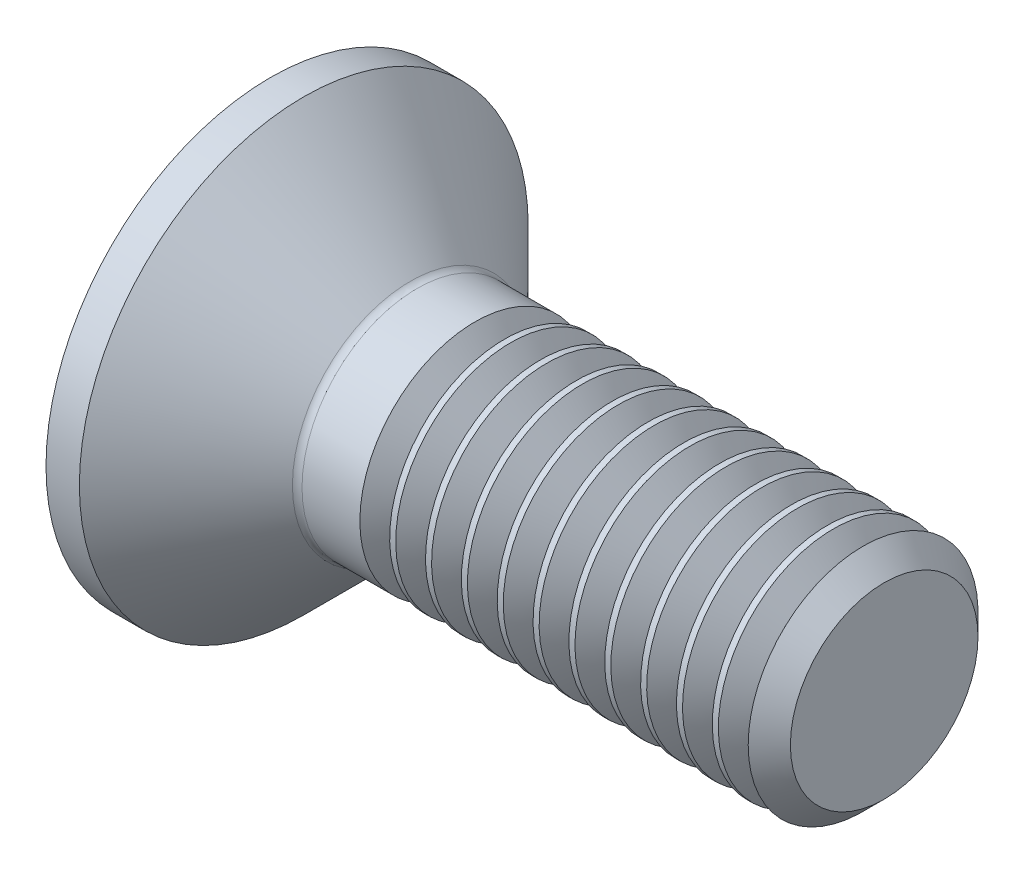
SolidWorks part; units mm, degrees
ref_plane "Plane1" through (0, 0, 0) normal (0, 0, 1) x (1, 0, 0)
ref_plane "Plane2" through (0, 0, 0) normal (0, 1, 0) x (1, 0, 0)
ref_plane "Plane3" through (0, 0, 0) normal (1, 0, 0) x (0, 0, -1)
sketch "BodySke" plane through (0, 0, 0) normal (0, 0, 1) x (1, 0, 0)
  line L0 (0, 0) -> (0, 5.85)
  line L1 (0.87, 5.85) -> (3.72, 3)
  line L2 (0, 5.85) -> (0.87, 5.85)
  line L3 (3.72, 3) -> (15.4455, 3)
  line L4 (16, 2.4455) -> (16, 0)
  line L5 (16, 0) -> (0, 0)
  line L6 (0, 0) -> (127, 0) construction
  line L7 (0.87, -5.85) -> (3.72, -3) construction
  line L8 (16, 2.4455) -> (15.4455, 3)
  line L9 (0, -5.85) -> (0.87, -5.85) construction
  line L10 (16, -2.4455) -> (15.4455, -3) construction
  line L11 (4.72, 9.35) -> (4.72, -12.875) construction
  line L12 (0, 19.05) -> (0, -3.175) construction
  dimension "D1" = 0.87
  dimension "Diameter" = 6
  dimension "Head_ht" = 3.72
  dimension "Length" = 16
  dimension "Body_ch_ang" = 45
  dimension "Head_dia" = 11.7
  dimension "Minor_dia" = 4.891
  dimension "Head_ang" = 90
  dimension "Advance" = 1
  dimension "Thread_nom" = 16
revolve "BaseBody" add sketch "BodySke" angle 360 about L6
fillet "Fillet1" radius 0.25 1 edges at (3.72, 0, 3)
sketch "Sketch2" plane through (0, 0, 0) normal (0, 0, 1) x (1, 0, 0)
  line L0 (0, 2) -> (2.2, 2)
  line L1 (2.2, 2) -> (3.3547, 0)
  line L2 (0, 0) -> (127, 0) construction
  line L3 (3.3547, 0) -> (0, 0)
  line L4 (0, 0) -> (0, 2)
  line L5 (0, -2) -> (2.2, -2) construction
  line L6 (0, 0) -> (47.625, 0) construction
  line L8 (0, 5.85) -> (0, -5.85) construction
  dimension "D2" = 60
  dimension "PreBroach_depth" = 2.2
  dimension "PreBroach_dia" = 4
revolve "PreBroach" cut sketch "Sketch2" angle 360 about L6
sketch "Sketch3" plane through (0, 0, 0) normal (-1, 0, 0) x (0, 0, 1)
  line L0 (-2, -1.1547) -> (-2, 1.1547)
  line L1 (-2, 1.1547) -> (0, 2.3094)
  line L2 (0, 2.3094) -> (2, 1.1547)
  line L3 (2, 1.1547) -> (2, -1.1547)
  line L4 (2, -1.1547) -> (0, -2.3094)
  line L5 (0, -2.3094) -> (-2, -1.1547)
  dimension "D1" = 2
  dimension "D2" = 2
  dimension "D3" = 4
  dimension "Hex_size" = 4
extrude "Hex" cut sketch "Sketch3" against normal blind 2.2
sketch "ThdSchSke" plane through (0, 0, 0) normal (0, 0, 1) x (1, 0, 0)
  line L0 (5.72, -2.4455) -> (5.3317, -3)
  line L1 (5.72, -2.4455) -> (6.1083, -3)
  line L2 (6.1083, -3) -> (6.1083, -3.75)
  line L3 (-3.175, 0) -> (5.1513, 0) construction
  line L4 (0, 5.85) -> (0, -5.85) construction
  line L5 (6.1083, -3.75) -> (5.3317, -3.75)
  line L6 (5.3317, -3.75) -> (5.3317, -3)
  dimension "Thread_minor" = 4.891
  dimension "Diameter" = 6
  dimension "Start" = 5.72
  dimension "SideAngle" = 55
  dimension "VeeAngle" = 70
  dimension "Overcut" = 7.5
revolve "ThreadSchematic" cut sketch "ThdSchSke" angle 360 about L3
pattern_linear "ThdSchPat" count 11 spacing 0.9345 along (1, 0, 0) of "ThreadSchematic"
equation "\"Thread_minor@ThreadCosmetic\"  =  \"Minor_dia@BodySke\""
equation "\"D1@Sketch3\" = \"Hex_size@Sketch3\" / 2"
equation "\"D2@Sketch3\" = \"D1@Sketch3\""
equation "\"D3@Sketch3\" = \"Hex_size@Sketch3\""
equation "\"Thread_length@ThreadCosmetic\" = ((sgn( (\"Length@BodySke\" - \"Advance@BodySke\" * 2.0 - \"Head_ht@BodySke\" ) - \"Thread_nom@BodySke\" )-1)*( (\"Length@BodySke\" - \"Advance@BodySke\" * 2.0 - \"Head_ht@BodySke\" "
equation "\"Thread_minor@ThdSchSke\" = \"Minor_dia@BodySke\""
equation "\"Diameter@ThdSchSke\" = \"Diameter@BodySke\""
equation "\"Overcut@ThdSchSke\" = \"Diameter@BodySke\" * 1.25"
equation "\"Start@ThdSchSke\" = 0.000001 + \"Length@BodySke\" - \"Thread_length@ThreadCosmetic\"  '---Countersunk---"
equation "\"Num_threads@ThdSchPat\" = int( \"Thread_length@ThreadCosmetic\" / \"Advance@BodySke\" + 0.999 )  + 1"
equation "\"Advance@ThdSchPat\" = \"Thread_length@ThreadCosmetic\" /  (\"Num_threads@ThdSchPat\" - 1) 'relax it"
equation "\"Num_threads@ThdSchPat\" = \"Num_threads@ThdSchPat\" - sgn( \"Num_threads@ThdSchPat\" - 1) '---chamfered tips only---"
